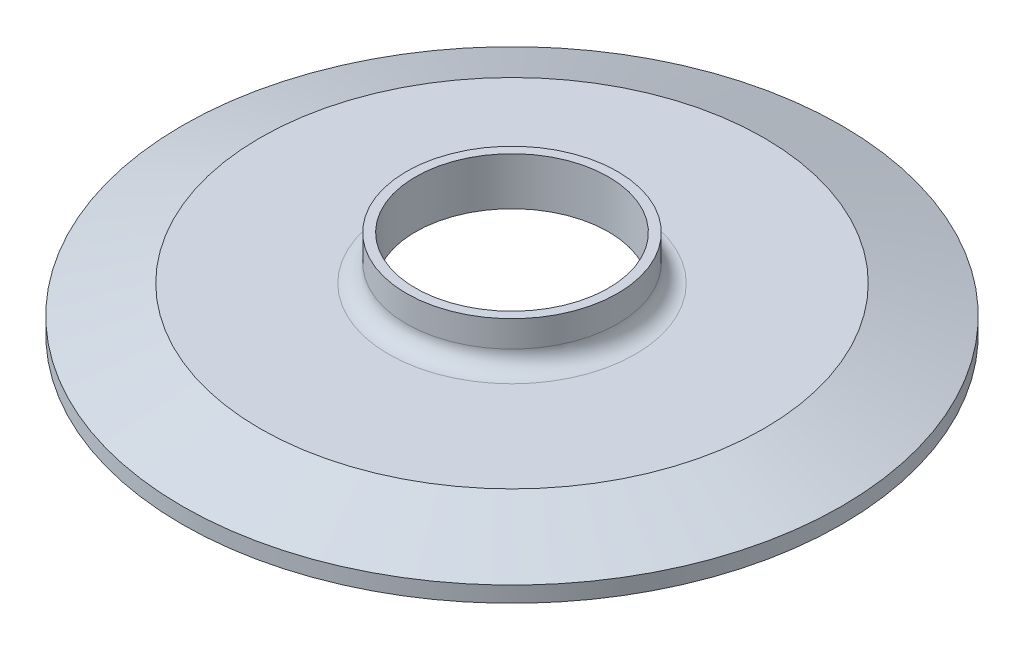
SolidWorks part; units mm, degrees
ref_plane "Front Plane" through (0, 0, 0) normal (0, 0, 1) x (1, 0, 0)
ref_plane "Top Plane" through (0, 0, 0) normal (0, 1, 0) x (1, 0, 0)
ref_plane "Right Plane" through (0, 0, 0) normal (1, 0, 0) x (0, 0, -1)
sketch "Sketch1" plane through (0, 0, 0) normal (0, 0, 1) x (1, 0, 0)
  line L0 (0, 0) -> (0, 8.8532) construction
  line L1 (-19.05, 15.875) -> (-19.05, 11.1252)
  line L2 (-22.225, 7.9502) -> (-45.4344, 7.9502)
  line L3 (-45.4344, 7.9502) -> (-59.4614, 2.8448)
  line L4 (-59.4614, 2.8448) -> (-59.4614, 0)
  line L5 (-59.4614, 0) -> (-56.9249, 0)
  line L6 (-48.6918, 0) -> (-52.8099, 0)
  line L10 (-48.6918, 0) -> (-17.399, 7.2821)
  line L11 (-17.399, 7.2821) -> (-17.399, 15.875)
  line L12 (-17.399, 15.875) -> (-19.05, 15.875)
  line L15 (-55.8994, 0.8729) -> (-56.0708, 0.4691)
  line L17 (-53.7016, 0.8729) -> (-53.5347, 0.4797)
  arc A0 (-22.225, 7.9502) -> (-19.05, 11.1252) centre (-22.225, 11.1252) ccw
  arc A1 (-56.0708, 0.4691) -> (-56.9249, 0) centre (-56.7956, 0.7767) cw
  arc A2 (-52.8099, 0) -> (-53.5347, 0.4797) centre (-52.8099, 0.7874) cw
  arc A3 (-53.7016, 0.8729) -> (-55.8994, 0.8729) centre (-54.8005, 0.4064) ccw
  dimension "D3" = 3.175
  dimension "D7" = 0.7874
  dimension "D8" = 54.8005
  dimension "D9" = 0.7874
  dimension "D15" = 1.1938
  dimension "D2" = 17.399
  dimension "D4" = 15.875
  dimension "D5" = 7.9502
  dimension "D6" = 59.4614
  dimension "D10" = 20
  dimension "D11" = 48.6918
  dimension "D12" = 19.05
  dimension "D13" = 2.8448
  dimension "D14" = 76.9
  dimension "D16" = 0.4064
  dimension "D17" = 46
  dimension "D18" = 2.8448
revolve "Revolve1" add sketch "Sketch1" angle 360 about L0
